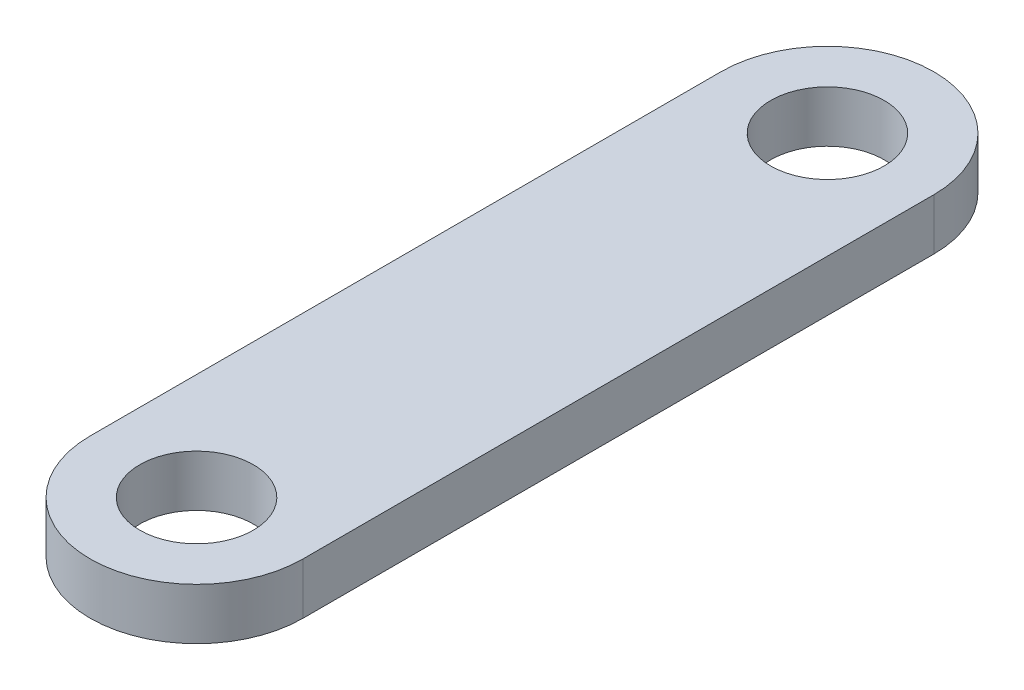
SolidWorks part; units mm, degrees
ref_plane "Frontal Plane" through (0, 0, 0) normal (0, 0, 1) x (1, 0, 0)
ref_plane "Horizontal Plane" through (0, 0, 0) normal (0, 1, 0) x (1, 0, 0)
ref_plane "Profile Plane" through (0, 0, 0) normal (1, 0, 0) x (0, 0, -1)
sketch "Sketch1" plane through (0, 0, 0) normal (0, 1, 0) x (1, 0, 0)
  line L0 (0, 0) -> (0, 25.4) construction
  line L1 (-4.2864, 0) -> (-4.2864, 25.4)
  line L2 (4.2864, 25.4) -> (4.2864, 0)
  circle A0 centre (0, 0) radius 2.286
  circle A1 centre (0, 25.4) radius 2.286
  arc A2 (-4.2864, 25.4) -> (4.2864, 25.4) centre (0, 25.4) cw
  arc A3 (4.2864, 0) -> (-4.2864, 0) centre (0, 0) cw
  dimension "D2" = 4.572
  dimension "D1" = 25.4
extrude "Boss-Extrude1" add sketch "Sketch1" along normal blind 2.07
